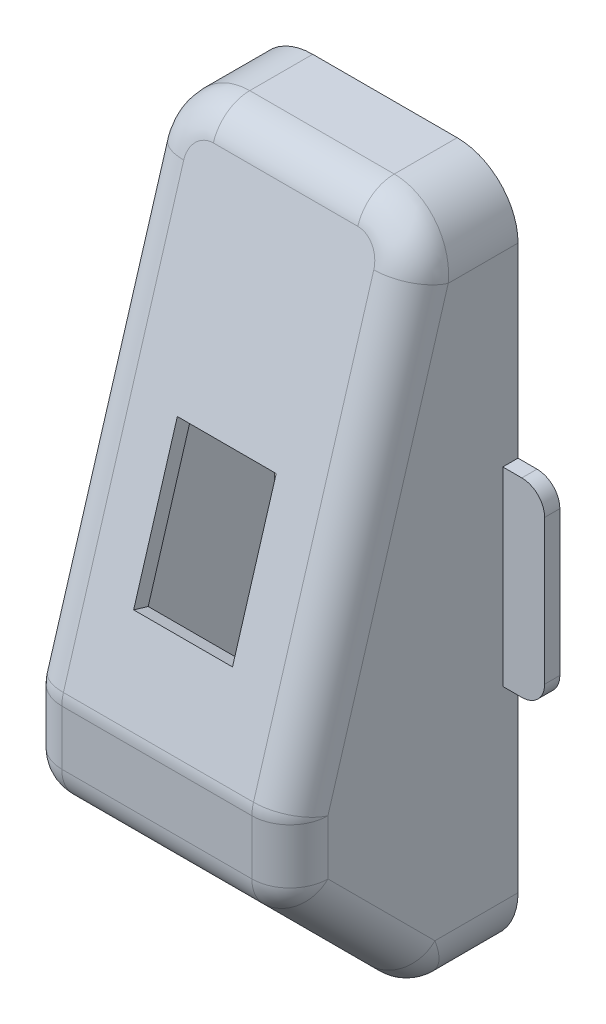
SolidWorks part; units mm, degrees
ref_plane "Спереди" through (0, 0, 0) normal (0, 0, 1) x (1, 0, 0)
ref_plane "Сверху" through (0, 0, 0) normal (0, 1, 0) x (1, 0, 0)
ref_plane "Справа" through (0, 0, 0) normal (1, 0, 0) x (0, 0, -1)
sketch "Эскиз1" plane through (0, 0, 0) normal (0, 0, 1) x (1, 0, 0)
  line L1 (-17.5, 90) -> (17.5, 90)
  line L2 (-17.5, 90) -> (-17.5, 0)
  line L3 (-17.5, 0) -> (17.5, 0)
  line L4 (17.5, 90) -> (17.5, 0)
  point P0 (-16.5193, 90)
  point P4 (0, 0)
  dimension "D1" = 35
  dimension "D2" = 90
extrude "Бобышка-Вытянуть1" add sketch "Эскиз1" along normal blind 30
sketch "Эскиз2" plane through (17.5, 0, 0) normal (1, 0, 0) x (0, 0, -1)
  line L0 (-30, 20) -> (-10, 0)
  line L1 (-30, 0) -> (-30, 90) construction
  line L3 (-10, 0) -> (-30, 0)
  line L4 (-30, 0) -> (-30, 20)
  point P4 (-28, 0)
  dimension "D1" = 10
  dimension "D2" = 45
extrude "Вырез-Вытянуть1" cut sketch "Эскиз2" against normal through all
sketch "Эскиз3" plane through (0, -5, 5) normal (0, -0.7071, 0.7071) x (1, 0, 0)
  line L0 (0, 7.0711) -> (0, 35.3553) construction
  line L1 (-17.5, 7.0711) -> (17.5, 7.0711) construction
  line L2 (-17.5, 35.3553) -> (17.5, 35.3553) construction
  line L3 (-17.5, 22.0711) -> (17.5, 22.0711) construction
  line L6 (17.5, 7.0711) -> (17.5, 35.3553) construction
  line L7 (-17.5, 7.0711) -> (-17.5, 35.3553) construction
  line L8 (-17.5, 7.0711) -> (17.5, 7.0711) construction
  circle A0 centre (0, 22.0711) radius 11
  point P8 (17.5, 21.669)
  point P11 (-17.5, 23.0077)
  dimension "D1" = 22
  dimension "D2" = 15
extrude "Вырез-Вытянуть2" cut sketch "Эскиз3" against normal blind 11
sketch "Эскиз4" plane through (0, 0, 0) normal (1, 0, 0) x (0, 0, -1)
  line L0 (0, 65) -> (-28, 65)
  line L2 (-28, 65) -> (-28, 39)
  line L3 (-28, 39) -> (0, 11)
  line L4 (0, 90) -> (0, 0) construction
  line L5 (0, 11) -> (0, 65)
  line L7 (-30, 90) -> (-30, 20) construction
  line L9 (-20.6066, 26.163) -> (-5.0503, 10.6066) construction
  line L11 (0, 0) -> (0, 90) construction
  line L12 (-30, 90) -> (0, 90) construction
  point P2 (0, 87.1925)
  dimension "D1" = 45
  dimension "D2" = 25
  dimension "D3" = 2
  dimension "D4" = 3.8492
  dimension "D5" = 11
extrude "Вырез-Вытянуть3" cut sketch "Эскиз4" against normal mid plane 29
sketch "Эскиз5" plane through (0, 2.7782, -2.7782) normal (0, -0.7071, 0.7071) x (1, 0, 0)
  circle A0 centre (0, 22.0711) radius 5.1
  dimension "D1" = 10.2
extrude "Вырез-Вытянуть4" cut sketch "Эскиз5" against normal blind 5
sketch "Эскиз6" plane through (17.5, 0, 0) normal (1, 0, 0) x (0, 0, -1)
  line L0 (-30, 30) -> (-12, 90)
  line L1 (-30, 20) -> (-30, 90) construction
  line L3 (-12, 90) -> (-30, 90)
  line L4 (-30, 90) -> (-30, 30)
  line L6 (-30, 90) -> (0, 90) construction
  line L7 (-30, 20) -> (-30, 90) construction
  line L8 (0, 0) -> (0, 90) construction
  point P4 (-28, 90)
  dimension "D1" = 12
  dimension "D2" = 60
extrude "Вырез-Вытянуть5" cut sketch "Эскиз6" against normal up to surface (35 mm away)
sketch "Эскиз7" plane through (0, 0, 0) normal (1, 0, 0) x (0, 0, -1)
  line L0 (-27.4615, 38.4615) -> (-19.5, 65)
  line L1 (-19.5, 65) -> (-17.4119, 65)
  line L2 (0, 65) -> (-19.5, 65) construction
  line L3 (-17.4119, 65) -> (-25.8553, 36.8553)
  line L4 (-27.4615, 38.4615) -> (0, 11) construction
  line L5 (-25.8553, 36.8553) -> (-27.4615, 38.4615)
  dimension "D1" = 2
extrude "Бобышка-Вытянуть2" add sketch "Эскиз7" along normal mid plane 29
sketch "Эскиз8" plane through (0, 10.7339, 35.7798) normal (0, 0.2873, 0.9578) x (1, 0, 0)
  line L0 (0, 20.1144) -> (0, 82.7562) construction
  line L1 (-17.5, 20.1144) -> (17.5, 20.1144) construction
  line L2 (-17.5, 82.7562) -> (17.5, 82.7562) construction
  line L4 (-6.5, 52.1144) -> (6.5, 52.1144)
  line L5 (-6.5, 52.1144) -> (-6.5, 32.1144)
  line L6 (-6.5, 32.1144) -> (6.5, 32.1144)
  line L7 (6.5, 52.1144) -> (6.5, 32.1144)
  point P10 (0, 32.1144)
  dimension "D1" = 13
  dimension "D2" = 20
  dimension "D3" = 12
extrude "Вырез-Вытянуть6" cut sketch "Эскиз8" against normal blind 3
fillet "Скругление2" radius 8 4 edges at (17.5, 0, 5) (-17.5, 0, 5) (-17.5, 90, 6) (17.5, 90, 6)
fillet "Скругление3" radius 4 2 edges at (-14.5, 65, 8.706) (14.5, 65, 8.706)
fillet "Скругление4" radius 5 2 edges at (0, 20, 30) (0, 30, 30)
fillet "Скругление5" radius 5 16 edges at (17.5, 29.9922, 29.947) (17.5, 25.6686, 30) (17.5, 20.1577, 29.6194) (17.5, 13.2678, 23.2678) (15.1569, 2.3431, 12.3431) (0, 0, 10) (-15.1569, 2.3431, 12.3431) (-17.5, 13.2678, 23.2678) (-17.5, 20.1577, 29.6194) (-17.5, 25.6686, 30) (-17.5, 29.9922, 29.947) (-17.5, 56.3514, 22.0946) (-15.1569, 87.6569, 12.7029) (0, 90, 12) (15.1569, 87.6569, 12.7029) (17.5, 56.3514, 22.0946)
sketch "Эскиз9" plane through (0, 0, 0) normal (0, 0, -1) x (-1, 0, 0)
  line L0 (10.5, 65) -> (-10.5, 65) construction
  line L1 (-4, 65) -> (4, 65)
  line L2 (-4, 65) -> (-4, 69)
  line L4 (4, 65) -> (4, 69)
  line L5 (0, 0) -> (0, 90) construction
  line L6 (-9.5, 90) -> (9.5, 90) construction
  line L7 (-10.5, 65) -> (10.5, 65) construction
  line L9 (-14.5, 15) -> (14.5, 15)
  line L10 (-14.5, 15) -> (-14.5, 7)
  line L11 (-10.5, 3) -> (-3.5, 3)
  line L12 (14.5, 15) -> (14.5, 7)
  line L13 (9.5, 0) -> (-9.5, 0) construction
  line L14 (3.5, 3) -> (10.5, 3)
  line L16 (-3.5, 3) -> (-3.5, 0)
  line L17 (-3.5, 0) -> (3.5, 0)
  line L18 (3.5, 3) -> (3.5, 0)
  line L19 (14.5, 11) -> (14.5, 61) construction
  arc A0 (4, 69) -> (-4, 69) centre (0, 69) ccw
  arc A1 (10.5, 3) -> (14.5, 7) centre (10.5, 7) ccw
  arc A2 (-14.5, 7) -> (-10.5, 3) centre (-10.5, 7) ccw
  point P20 (0, 15)
  point P29 (0, 0)
  point P30 (14.5, 15)
  dimension "D1" = 4
  dimension "D2" = 4
  dimension "D5" = 4
  dimension "D4" = 12
  dimension "D6" = 3
  dimension "D7" = 7
extrude "Вырез-Вытянуть7" cut sketch "Эскиз9" against normal blind 2
sketch "Эскиз12" plane through (0, 0, 2) normal (0, 0, -1) x (-1, 0, 0)
  line L0 (-3.5, 3) -> (-3.5, 0)
  line L1 (-3.5, 0) -> (3.5, 0)
  line L2 (-3.5, 3) -> (-12.3192, 13)
  line L3 (14.5, 13) -> (-14.5, 13) construction
  line L4 (-12.3192, 13) -> (-12.3192, 18)
  line L5 (-12.3192, 18) -> (-8.3192, 18)
  line L6 (-8.3192, 18) -> (-8.3192, 13)
  line L7 (-8.3192, 13) -> (-3.0277, 7)
  line L8 (0, 0) -> (0, 13) construction
  line L9 (3.5, 3) -> (3.5, 0)
  line L10 (3.5, 3) -> (12.3192, 13)
  line L11 (12.3192, 13) -> (12.3192, 18)
  line L12 (12.3192, 18) -> (8.3192, 18)
  line L13 (8.3192, 18) -> (8.3192, 13)
  line L14 (8.3192, 13) -> (3.0277, 7)
  line L15 (-3.0277, 7) -> (3.0277, 7)
  point P4 (0, 7)
  dimension "D1" = 3
  dimension "D2" = 4
  dimension "D3" = 5
  dimension "D4" = 7
extrude "Вырез-Вытянуть9" cut sketch "Эскиз12" against normal blind 2
sketch "Эскиз13" plane through (0, 0, 0) normal (0, 0, -1) x (-1, 0, 0)
  line L0 (0, 0) -> (0, 90) construction
  line L1 (-9.5, 90) -> (9.5, 90) construction
  line L2 (-17.5, 8) -> (-17.5, 82) construction
  line L3 (-17.5, 32.5) -> (-20, 32.5)
  line L4 (-17.5, 32.5) -> (-17.5, 57.5)
  line L5 (-17.5, 57.5) -> (-20, 57.5)
  line L6 (-23, 35.5) -> (-23, 54.5)
  line L7 (17.5, 57.5) -> (20, 57.5)
  line L8 (23, 35.5) -> (23, 54.5)
  line L9 (17.5, 32.5) -> (20, 32.5)
  line L10 (17.5, 32.5) -> (17.5, 57.5)
  arc A0 (-20, 57.5) -> (-23, 54.5) centre (-20, 54.5) ccw
  arc A1 (-20, 32.5) -> (-23, 35.5) centre (-20, 35.5) cw
  arc A2 (20, 57.5) -> (23, 54.5) centre (20, 54.5) cw
  arc A3 (20, 32.5) -> (23, 35.5) centre (20, 35.5) ccw
  point P15 (-17.5, 45)
  point P16 (-17.5, 45)
  dimension "D1" = 3
  dimension "D2" = 25
  dimension "D3" = 46
extrude "Бобышка-Вытянуть3" add sketch "Эскиз13" against normal blind 2
